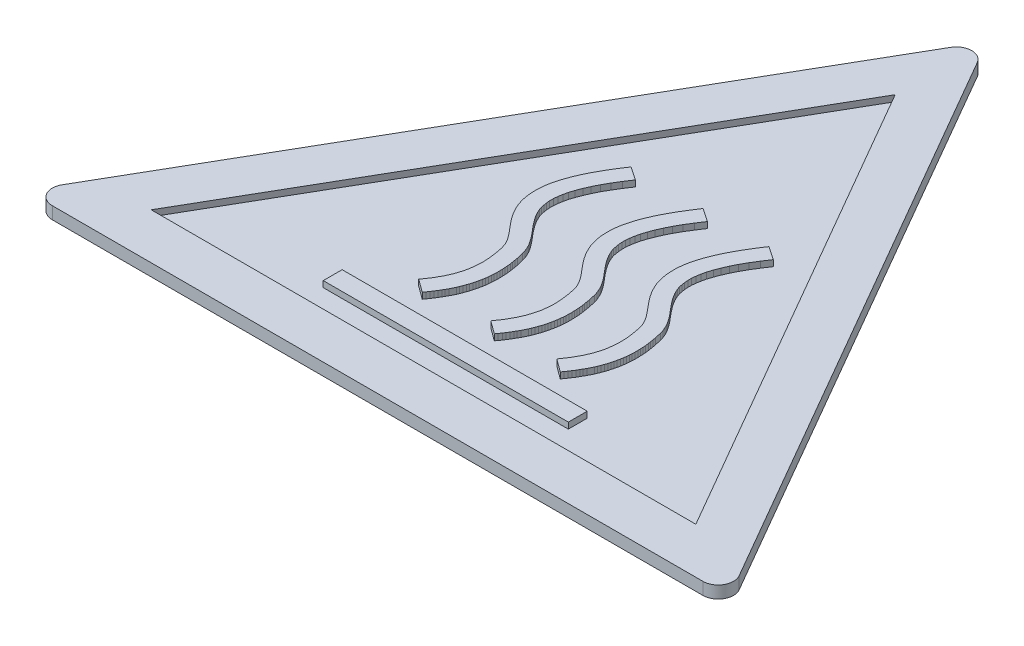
SolidWorks part; units mm, degrees
ref_plane "Vorne" through (0, 0, 0) normal (0, 0, 1) x (1, 0, 0)
ref_plane "Oben" through (0, 0, 0) normal (0, 1, 0) x (1, 0, 0)
ref_plane "Rechts" through (0, 0, 0) normal (1, 0, 0) x (0, 0, -1)
sketch "Skizze1" plane through (0, 0, 0) normal (0, 1, 0) x (1, 0, 0)
  line L0 (-15.8835, 2.5) -> (18.1545, 2.5) construction
  line L1 (0, -5.5346) -> (0, 10.5158) construction
  line L3 (-12.5, 15) -> (12.5, 15)
  line L4 (-12.5, 15) -> (-12.5, -10)
  line L5 (-12.5, -10) -> (12.5, -10)
  line L6 (12.5, 15) -> (12.5, -10)
  dimension "D1" = 25
  dimension "D2" = 25
  dimension "D3" = 2.5
extrude "Linear austragen1" add sketch "Skizze1" along normal blind 0.2
sketch "Skizze2" plane through (0, 0.2, 0) normal (0, 1, 0) x (-1, 0, 0)
  line L0 (11.5, 6.6395) -> (-5.75, -3.3198) construction
  line L1 (-11.5, 6.6395) -> (5.75, -3.3198) construction
  line L2 (0, -13.2791) -> (0, 6.6395) construction
  line L3 (11.5, 6.6395) -> (0, -13.2791)
  line L4 (0, -13.2791) -> (-11.5, 6.6395)
  line L5 (-11.5, 6.6395) -> (11.5, 6.6395)
  point P0 (0, 0)
  dimension "D1" = 23
extrude "Linear-Austragen-Dünn1" add sketch "Skizze2" along normal blind 0.2 thin
fillet "Verrundung1" radius 0.5 3 edges at (0, 0.3, -13.2791) (11.5, 0.3, 6.6395) (-11.5, 0.3, 6.6395)
sketch "Skizze3" plane through (-0.9352, 0.2, 1.0338) normal (0, 1, 0) x (1, 0, 0)
  line L0 (-0.6601, 0.7186) -> (-0.6939, 0.8367)
  line L3 (-0.6939, 0.8367) -> (-0.7411, 0.9481)
  line L4 (-0.7411, 0.9481) -> (-0.7917, 1.0527)
  line L5 (-0.7917, 1.0527) -> (-0.8525, 1.1505)
  line L6 (-0.8525, 1.1505) -> (-0.9166, 1.245)
  line L7 (-0.9166, 1.245) -> (-0.9841, 1.3361)
  line L8 (-0.9841, 1.3361) -> (-1.0516, 1.4205)
  line L9 (-1.0516, 1.4205) -> (-1.1225, 1.5049)
  line L10 (-1.1225, 1.5049) -> (-1.1899, 1.5859)
  line L11 (-1.1899, 1.5859) -> (-1.2608, 1.6702)
  line L12 (-1.2608, 1.6702) -> (-1.3216, 1.7479)
  line L13 (-1.3216, 1.7479) -> (-1.3857, 1.8322)
  line L14 (-1.3857, 1.8322) -> (-1.443, 1.9098)
  line L15 (-1.443, 1.9098) -> (-1.497, 1.9942)
  line L16 (-1.497, 1.9942) -> (-1.5477, 2.0786)
  line L17 (-1.5477, 2.0786) -> (-1.5915, 2.1663)
  line L18 (-1.5915, 2.1663) -> (-1.632, 2.2574)
  line L19 (-1.632, 2.2574) -> (-1.6624, 2.3452)
  line L20 (-1.6624, 2.3452) -> (-1.6826, 2.4464)
  line L21 (-1.6826, 2.4464) -> (-1.6995, 2.551)
  line L22 (-1.6995, 2.551) -> (-1.7096, 2.6658)
  line L23 (-1.7096, 2.6658) -> (-1.7096, 2.7872)
  line L24 (-1.7096, 2.7872) -> (-1.6961, 2.9155)
  line L25 (-1.6961, 2.9155) -> (-1.6725, 3.0572)
  line L26 (-1.6725, 3.0572) -> (-1.6388, 3.2091)
  line L27 (-1.6388, 3.2091) -> (-1.5848, 3.3744)
  line L28 (-1.5848, 3.3744) -> (-1.5173, 3.5533)
  line L29 (-1.5173, 3.5533) -> (-1.4329, 3.7456)
  line L30 (-1.4329, 3.7456) -> (-1.3317, 3.9515)
  line L31 (-1.3317, 3.9515) -> (-1.2102, 4.1675)
  line L32 (-1.2102, 4.1675) -> (-1.0651, 4.4037)
  line L33 (-1.0651, 4.4037) -> (-0.8997, 4.6534)
  line L34 (-0.8997, 4.6534) -> (-1.3384, 4.9504)
  line L35 (-1.3384, 4.9504) -> (-1.5105, 4.6872)
  line L36 (-1.5105, 4.6872) -> (-1.6624, 4.4374)
  line L37 (-1.6624, 4.4374) -> (-1.7974, 4.1945)
  line L38 (-1.7974, 4.1945) -> (-1.9121, 3.9684)
  line L39 (-1.9121, 3.9684) -> (-2.0032, 3.7558)
  line L40 (-2.0032, 3.7558) -> (-2.0842, 3.5499)
  line L41 (-2.0842, 3.5499) -> (-2.145, 3.3508)
  line L42 (-2.145, 3.3508) -> (-2.1922, 3.1652)
  line L43 (-2.1922, 3.1652) -> (-2.2226, 2.983)
  line L44 (-2.2226, 2.983) -> (-2.2361, 2.8075)
  line L45 (-2.2361, 2.8075) -> (-2.2361, 2.6455)
  line L46 (-2.2361, 2.6455) -> (-2.226, 2.4903)
  line L47 (-2.226, 2.4903) -> (-2.2023, 2.3452)
  line L48 (-2.2023, 2.3452) -> (-2.1686, 2.2034)
  line L49 (-2.1686, 2.2034) -> (-2.1247, 2.0684)
  line L50 (-2.1247, 2.0684) -> (-2.0707, 1.9436)
  line L51 (-2.0707, 1.9436) -> (-2.0134, 1.8288)
  line L52 (-2.0134, 1.8288) -> (-1.9492, 1.7175)
  line L53 (-1.9492, 1.7175) -> (-1.8818, 1.6129)
  line L54 (-1.8818, 1.6129) -> (-1.8109, 1.515)
  line L55 (-1.8109, 1.515) -> (-1.74, 1.4239)
  line L56 (-1.74, 1.4239) -> (-1.6658, 1.3328)
  line L57 (-1.6658, 1.3328) -> (-1.5949, 1.2484)
  line L58 (-1.5949, 1.2484) -> (-1.5274, 1.1674)
  line L59 (-1.5274, 1.1674) -> (-1.4633, 1.0898)
  line L60 (-1.4633, 1.0898) -> (-1.4026, 1.0122)
  line L61 (-1.4026, 1.0122) -> (-1.3486, 0.9413)
  line L62 (-1.3486, 0.9413) -> (-1.2979, 0.8671)
  line L63 (-1.2979, 0.8671) -> (-1.2574, 0.7962)
  line L64 (-1.2574, 0.7962) -> (-1.2203, 0.7253)
  line L65 (-1.2203, 0.7253) -> (-1.1933, 0.6612)
  line L66 (-1.1933, 0.6612) -> (-1.1731, 0.5903)
  line L68 (-1.2034, -2.0081) -> (-1.1495, -1.9339)
  line L69 (-1.1495, -1.9339) -> (-1.0955, -1.8563)
  line L70 (-1.0955, -1.8563) -> (-1.0482, -1.782)
  line L71 (-1.0482, -1.782) -> (-0.9942, -1.701)
  line L72 (-0.9942, -1.701) -> (-0.9503, -1.62)
  line L73 (-0.9503, -1.62) -> (-0.9099, -1.5526)
  line L74 (-0.9099, -1.5526) -> (-0.866, -1.4749)
  line L75 (-0.866, -1.4749) -> (-0.8255, -1.3939)
  line L76 (-0.8255, -1.3939) -> (-0.785, -1.313)
  line L77 (-0.785, -1.313) -> (-0.7546, -1.2387)
  line L78 (-0.7546, -1.2387) -> (-0.7209, -1.1543)
  line L79 (-0.7209, -1.1543) -> (-0.6939, -1.0734)
  line L80 (-0.6939, -1.0734) -> (-0.6635, -0.9957)
  line L81 (-0.6635, -0.9957) -> (-0.6433, -0.9114)
  line L82 (-0.6433, -0.9114) -> (-0.6196, -0.8304)
  line L83 (-0.6196, -0.8304) -> (-0.6028, -0.7494)
  line L84 (-0.6028, -0.7494) -> (-0.5825, -0.6583)
  line L85 (-0.5825, -0.6583) -> (-0.569, -0.5739)
  line L86 (-0.569, -0.5739) -> (-0.5589, -0.4895)
  line L87 (-0.5589, -0.4895) -> (-0.5521, -0.4018)
  line L88 (-0.5521, -0.4018) -> (-0.5454, -0.3208)
  line L89 (-0.5454, -0.3208) -> (-0.542, -0.2297)
  line L90 (-0.542, -0.2297) -> (-0.542, -0.1352)
  line L91 (-0.542, -0.1352) -> (-0.5454, -0.0475)
  line L92 (-0.5454, -0.0475) -> (-0.5488, 0.0437)
  line L93 (-0.5488, 0.0437) -> (-0.5555, 0.1348)
  line L94 (-0.5555, 0.1348) -> (-0.5656, 0.2326)
  line L95 (-0.5656, 0.2326) -> (-0.5825, 0.3271)
  line L96 (-0.5825, 0.3271) -> (-0.596, 0.4182)
  line L97 (-0.596, 0.4182) -> (-0.6129, 0.5161)
  line L98 (-0.6129, 0.5161) -> (-0.6365, 0.6173)
  line L99 (-0.6365, 0.6173) -> (-0.6601, 0.7186)
  line L101 (-1.1731, 0.5903) -> (-1.1495, 0.5026)
  line L102 (-1.1495, 0.5026) -> (-1.1326, 0.4149)
  line L103 (-1.1326, 0.4149) -> (-1.1157, 0.3305)
  line L104 (-1.1157, 0.3305) -> (-1.1022, 0.2461)
  line L105 (-1.1022, 0.2461) -> (-1.0921, 0.1651)
  line L106 (-1.0921, 0.1651) -> (-1.082, 0.0875)
  line L107 (-1.082, 0.0875) -> (-1.0752, 0.0099)
  line L108 (-1.0752, 0.0099) -> (-1.0718, -0.0677)
  line L109 (-1.0718, -0.0677) -> (-1.0685, -0.1487)
  line L110 (-1.0685, -0.1487) -> (-1.0685, -0.2162)
  line L111 (-1.0685, -0.2162) -> (-1.0718, -0.2871)
  line L112 (-1.0718, -0.2871) -> (-1.0786, -0.3613)
  line L113 (-1.0786, -0.3613) -> (-1.0853, -0.4355)
  line L114 (-1.0853, -0.4355) -> (-1.0955, -0.5064)
  line L115 (-1.0955, -0.5064) -> (-1.1022, -0.5705)
  line L116 (-1.1022, -0.5705) -> (-1.1157, -0.6347)
  line L117 (-1.1157, -0.6347) -> (-1.1326, -0.7021)
  line L118 (-1.1326, -0.7021) -> (-1.1495, -0.7696)
  line L119 (-1.1495, -0.7696) -> (-1.1697, -0.8338)
  line L120 (-1.1697, -0.8338) -> (-1.1933, -0.9046)
  line L121 (-1.1933, -0.9046) -> (-1.2136, -0.9721)
  line L122 (-1.2136, -0.9721) -> (-1.2406, -1.0295)
  line L123 (-1.2406, -1.0295) -> (-1.2709, -1.097)
  line L124 (-1.2709, -1.097) -> (-1.2979, -1.1645)
  line L125 (-1.2979, -1.1645) -> (-1.3317, -1.2252)
  line L126 (-1.3317, -1.2252) -> (-1.3688, -1.2893)
  line L127 (-1.3688, -1.2893) -> (-1.4093, -1.3636)
  line L128 (-1.4093, -1.3636) -> (-1.4464, -1.4311)
  line L129 (-1.4464, -1.4311) -> (-1.4869, -1.4918)
  line L130 (-1.4869, -1.4918) -> (-1.5342, -1.5593)
  line L131 (-1.5342, -1.5593) -> (-1.5814, -1.6302)
  line L132 (-1.5814, -1.6302) -> (-1.6287, -1.6977)
  line L133 (-1.6287, -1.6977) -> (-1.2034, -2.0081)
  line L134 (1.6954, 0.7186) -> (1.6616, 0.8367)
  line L135 (1.6616, 0.8367) -> (1.6144, 0.9481)
  line L136 (1.6144, 0.9481) -> (1.5638, 1.0527)
  line L137 (1.5638, 1.0527) -> (1.503, 1.1505)
  line L138 (1.503, 1.1505) -> (1.4389, 1.245)
  line L139 (1.4389, 1.245) -> (1.3714, 1.3361)
  line L140 (1.3714, 1.3361) -> (1.3039, 1.4205)
  line L141 (1.3039, 1.4205) -> (1.2331, 1.5049)
  line L142 (1.2331, 1.5049) -> (1.1656, 1.5859)
  line L143 (1.1656, 1.5859) -> (1.0947, 1.6702)
  line L144 (1.0947, 1.6702) -> (1.0339, 1.7479)
  line L145 (1.0339, 1.7479) -> (0.9698, 1.8322)
  line L146 (0.9698, 1.8322) -> (0.9125, 1.9098)
  line L147 (0.9125, 1.9098) -> (0.8585, 1.9942)
  line L148 (0.8585, 1.9942) -> (0.8078, 2.0786)
  line L149 (0.8078, 2.0786) -> (0.764, 2.1663)
  line L150 (0.764, 2.1663) -> (0.7235, 2.2574)
  line L151 (0.7235, 2.2574) -> (0.6931, 2.3452)
  line L152 (0.6931, 2.3452) -> (0.6729, 2.4464)
  line L153 (0.6729, 2.4464) -> (0.656, 2.551)
  line L154 (0.656, 2.551) -> (0.6459, 2.6658)
  line L155 (0.6459, 2.6658) -> (0.6459, 2.7872)
  line L156 (0.6459, 2.7872) -> (0.6594, 2.9155)
  line L157 (0.6594, 2.9155) -> (0.683, 3.0572)
  line L158 (0.683, 3.0572) -> (0.7167, 3.2091)
  line L159 (0.7167, 3.2091) -> (0.7707, 3.3744)
  line L160 (0.7707, 3.3744) -> (0.8382, 3.5533)
  line L161 (0.8382, 3.5533) -> (0.9226, 3.7456)
  line L162 (0.9226, 3.7456) -> (1.0238, 3.9515)
  line L163 (1.0238, 3.9515) -> (1.1453, 4.1675)
  line L164 (1.1453, 4.1675) -> (1.2904, 4.4037)
  line L165 (1.2904, 4.4037) -> (1.4558, 4.6534)
  line L166 (1.4558, 4.6534) -> (1.0171, 4.9504)
  line L167 (1.0171, 4.9504) -> (0.845, 4.6872)
  line L168 (0.845, 4.6872) -> (0.6931, 4.4374)
  line L169 (0.6931, 4.4374) -> (0.5581, 4.1945)
  line L170 (0.5581, 4.1945) -> (0.4434, 3.9684)
  line L171 (0.4434, 3.9684) -> (0.3523, 3.7558)
  line L172 (0.3523, 3.7558) -> (0.2713, 3.5499)
  line L173 (0.2713, 3.5499) -> (0.2105, 3.3508)
  line L174 (0.2105, 3.3508) -> (0.1633, 3.1652)
  line L175 (0.1633, 3.1652) -> (0.1329, 2.983)
  line L176 (0.1329, 2.983) -> (0.1194, 2.8075)
  line L177 (0.1194, 2.8075) -> (0.1194, 2.6455)
  line L178 (0.1194, 2.6455) -> (0.1295, 2.4903)
  line L179 (0.1295, 2.4903) -> (0.1532, 2.3452)
  line L180 (0.1532, 2.3452) -> (0.1869, 2.2034)
  line L181 (0.1869, 2.2034) -> (0.2308, 2.0684)
  line L182 (0.2308, 2.0684) -> (0.2848, 1.9436)
  line L183 (0.2848, 1.9436) -> (0.3421, 1.8288)
  line L184 (0.3421, 1.8288) -> (0.4063, 1.7175)
  line L185 (0.4063, 1.7175) -> (0.4738, 1.6129)
  line L186 (0.4738, 1.6129) -> (0.5446, 1.515)
  line L187 (0.5446, 1.515) -> (0.6155, 1.4239)
  line L188 (0.6155, 1.4239) -> (0.6897, 1.3328)
  line L189 (0.6897, 1.3328) -> (0.7606, 1.2484)
  line L190 (0.7606, 1.2484) -> (0.8281, 1.1674)
  line L191 (0.8281, 1.1674) -> (0.8922, 1.0898)
  line L192 (0.8922, 1.0898) -> (0.953, 1.0122)
  line L193 (0.953, 1.0122) -> (1.007, 0.9413)
  line L194 (1.007, 0.9413) -> (1.0576, 0.8671)
  line L195 (1.0576, 0.8671) -> (1.0981, 0.7962)
  line L196 (1.0981, 0.7962) -> (1.1352, 0.7253)
  line L197 (1.1352, 0.7253) -> (1.1622, 0.6612)
  line L198 (1.1622, 0.6612) -> (1.1824, 0.5903)
  line L200 (1.1521, -2.0081) -> (1.2061, -1.9339)
  line L201 (1.2061, -1.9339) -> (1.26, -1.8563)
  line L202 (1.26, -1.8563) -> (1.3073, -1.782)
  line L203 (1.3073, -1.782) -> (1.3613, -1.701)
  line L204 (1.3613, -1.701) -> (1.4052, -1.62)
  line L205 (1.4052, -1.62) -> (1.4457, -1.5526)
  line L206 (1.4457, -1.5526) -> (1.4895, -1.4749)
  line L207 (1.4895, -1.4749) -> (1.53, -1.3939)
  line L208 (1.53, -1.3939) -> (1.5705, -1.313)
  line L209 (1.5705, -1.313) -> (1.6009, -1.2387)
  line L210 (1.6009, -1.2387) -> (1.6346, -1.1543)
  line L211 (1.6346, -1.1543) -> (1.6616, -1.0734)
  line L212 (1.6616, -1.0734) -> (1.692, -0.9957)
  line L213 (1.692, -0.9957) -> (1.7123, -0.9114)
  line L214 (1.7123, -0.9114) -> (1.7359, -0.8304)
  line L215 (1.7359, -0.8304) -> (1.7527, -0.7494)
  line L216 (1.7527, -0.7494) -> (1.773, -0.6583)
  line L217 (1.773, -0.6583) -> (1.7865, -0.5739)
  line L218 (1.7865, -0.5739) -> (1.7966, -0.4895)
  line L219 (1.7966, -0.4895) -> (1.8034, -0.4018)
  line L220 (1.8034, -0.4018) -> (1.8101, -0.3208)
  line L221 (1.8101, -0.3208) -> (1.8135, -0.2297)
  line L222 (1.8135, -0.2297) -> (1.8135, -0.1352)
  line L223 (1.8135, -0.1352) -> (1.8101, -0.0475)
  line L224 (1.8101, -0.0475) -> (1.8067, 0.0437)
  line L225 (1.8067, 0.0437) -> (1.8, 0.1348)
  line L226 (1.8, 0.1348) -> (1.7899, 0.2326)
  line L227 (1.7899, 0.2326) -> (1.773, 0.3271)
  line L228 (1.773, 0.3271) -> (1.7595, 0.4182)
  line L229 (1.7595, 0.4182) -> (1.7426, 0.5161)
  line L230 (1.7426, 0.5161) -> (1.719, 0.6173)
  line L231 (1.719, 0.6173) -> (1.6954, 0.7186)
  line L233 (1.1824, 0.5903) -> (1.2061, 0.5026)
  line L234 (1.2061, 0.5026) -> (1.2229, 0.4149)
  line L235 (1.2229, 0.4149) -> (1.2398, 0.3305)
  line L236 (1.2398, 0.3305) -> (1.2533, 0.2461)
  line L237 (1.2533, 0.2461) -> (1.2634, 0.1651)
  line L238 (1.2634, 0.1651) -> (1.2735, 0.0875)
  line L239 (1.2735, 0.0875) -> (1.2803, 0.0099)
  line L240 (1.2803, 0.0099) -> (1.2837, -0.0677)
  line L241 (1.2837, -0.0677) -> (1.287, -0.1487)
  line L242 (1.287, -0.1487) -> (1.287, -0.2162)
  line L243 (1.287, -0.2162) -> (1.2837, -0.2871)
  line L244 (1.2837, -0.2871) -> (1.2769, -0.3613)
  line L245 (1.2769, -0.3613) -> (1.2702, -0.4355)
  line L246 (1.2702, -0.4355) -> (1.26, -0.5064)
  line L247 (1.26, -0.5064) -> (1.2533, -0.5705)
  line L248 (1.2533, -0.5705) -> (1.2398, -0.6347)
  line L249 (1.2398, -0.6347) -> (1.2229, -0.7021)
  line L250 (1.2229, -0.7021) -> (1.2061, -0.7696)
  line L251 (1.2061, -0.7696) -> (1.1858, -0.8338)
  line L252 (1.1858, -0.8338) -> (1.1622, -0.9046)
  line L253 (1.1622, -0.9046) -> (1.1419, -0.9721)
  line L254 (1.1419, -0.9721) -> (1.1149, -1.0295)
  line L255 (1.1149, -1.0295) -> (1.0846, -1.097)
  line L256 (1.0846, -1.097) -> (1.0576, -1.1645)
  line L257 (1.0576, -1.1645) -> (1.0238, -1.2252)
  line L258 (1.0238, -1.2252) -> (0.9867, -1.2893)
  line L259 (0.9867, -1.2893) -> (0.9462, -1.3636)
  line L260 (0.9462, -1.3636) -> (0.9091, -1.4311)
  line L261 (0.9091, -1.4311) -> (0.8686, -1.4918)
  line L262 (0.8686, -1.4918) -> (0.8213, -1.5593)
  line L263 (0.8213, -1.5593) -> (0.7741, -1.6302)
  line L264 (0.7741, -1.6302) -> (0.7269, -1.6977)
  line L265 (0.7269, -1.6977) -> (1.1521, -2.0081)
  line L266 (3.8518, 0.7186) -> (3.818, 0.8367)
  line L267 (3.818, 0.8367) -> (3.7708, 0.9481)
  line L268 (3.7708, 0.9481) -> (3.7202, 1.0527)
  line L269 (3.7202, 1.0527) -> (3.6594, 1.1505)
  line L270 (3.6594, 1.1505) -> (3.5953, 1.245)
  line L271 (3.5953, 1.245) -> (3.5278, 1.3361)
  line L272 (3.5278, 1.3361) -> (3.4603, 1.4205)
  line L273 (3.4603, 1.4205) -> (3.3895, 1.5049)
  line L274 (3.3895, 1.5049) -> (3.322, 1.5859)
  line L275 (3.322, 1.5859) -> (3.2511, 1.6702)
  line L276 (3.2511, 1.6702) -> (3.1903, 1.7479)
  line L277 (3.1903, 1.7479) -> (3.1262, 1.8322)
  line L278 (3.1262, 1.8322) -> (3.0689, 1.9098)
  line L279 (3.0689, 1.9098) -> (3.0149, 1.9942)
  line L280 (3.0149, 1.9942) -> (2.9642, 2.0786)
  line L281 (2.9642, 2.0786) -> (2.9204, 2.1663)
  line L282 (2.9204, 2.1663) -> (2.8799, 2.2574)
  line L283 (2.8799, 2.2574) -> (2.8495, 2.3452)
  line L284 (2.8495, 2.3452) -> (2.8293, 2.4464)
  line L285 (2.8293, 2.4464) -> (2.8124, 2.551)
  line L286 (2.8124, 2.551) -> (2.8023, 2.6658)
  line L287 (2.8023, 2.6658) -> (2.8023, 2.7872)
  line L288 (2.8023, 2.7872) -> (2.8158, 2.9155)
  line L289 (2.8158, 2.9155) -> (2.8394, 3.0572)
  line L290 (2.8394, 3.0572) -> (2.8731, 3.2091)
  line L291 (2.8731, 3.2091) -> (2.9271, 3.3744)
  line L292 (2.9271, 3.3744) -> (2.9946, 3.5533)
  line L293 (2.9946, 3.5533) -> (3.079, 3.7456)
  line L294 (3.079, 3.7456) -> (3.1802, 3.9515)
  line L295 (3.1802, 3.9515) -> (3.3017, 4.1675)
  line L296 (3.3017, 4.1675) -> (3.4468, 4.4037)
  line L297 (3.4468, 4.4037) -> (3.6122, 4.6534)
  line L298 (3.6122, 4.6534) -> (3.1735, 4.9504)
  line L299 (3.1735, 4.9504) -> (3.0014, 4.6872)
  line L300 (3.0014, 4.6872) -> (2.8495, 4.4374)
  line L301 (2.8495, 4.4374) -> (2.7145, 4.1945)
  line L302 (2.7145, 4.1945) -> (2.5998, 3.9684)
  line L303 (2.5998, 3.9684) -> (2.5087, 3.7558)
  line L304 (2.5087, 3.7558) -> (2.4277, 3.5499)
  line L305 (2.4277, 3.5499) -> (2.3669, 3.3508)
  line L306 (2.3669, 3.3508) -> (2.3197, 3.1652)
  line L307 (2.3197, 3.1652) -> (2.2893, 2.983)
  line L308 (2.2893, 2.983) -> (2.2758, 2.8075)
  line L309 (2.2758, 2.8075) -> (2.2758, 2.6455)
  line L310 (2.2758, 2.6455) -> (2.2859, 2.4903)
  line L311 (2.2859, 2.4903) -> (2.3096, 2.3452)
  line L312 (2.3096, 2.3452) -> (2.3433, 2.2034)
  line L313 (2.3433, 2.2034) -> (2.3872, 2.0684)
  line L314 (2.3872, 2.0684) -> (2.4412, 1.9436)
  line L315 (2.4412, 1.9436) -> (2.4985, 1.8288)
  line L316 (2.4985, 1.8288) -> (2.5627, 1.7175)
  line L317 (2.5627, 1.7175) -> (2.6302, 1.6129)
  line L318 (2.6302, 1.6129) -> (2.701, 1.515)
  line L319 (2.701, 1.515) -> (2.7719, 1.4239)
  line L320 (2.7719, 1.4239) -> (2.8461, 1.3328)
  line L321 (2.8461, 1.3328) -> (2.917, 1.2484)
  line L322 (2.917, 1.2484) -> (2.9845, 1.1674)
  line L323 (2.9845, 1.1674) -> (3.0486, 1.0898)
  line L324 (3.0486, 1.0898) -> (3.1094, 1.0122)
  line L325 (3.1094, 1.0122) -> (3.1634, 0.9413)
  line L326 (3.1634, 0.9413) -> (3.214, 0.8671)
  line L327 (3.214, 0.8671) -> (3.2545, 0.7962)
  line L328 (3.2545, 0.7962) -> (3.2916, 0.7253)
  line L329 (3.2916, 0.7253) -> (3.3186, 0.6612)
  line L330 (3.3186, 0.6612) -> (3.3388, 0.5903)
  line L332 (3.3085, -2.0081) -> (3.3625, -1.9339)
  line L333 (3.3625, -1.9339) -> (3.4165, -1.8563)
  line L334 (3.4165, -1.8563) -> (3.4637, -1.782)
  line L335 (3.4637, -1.782) -> (3.5177, -1.701)
  line L336 (3.5177, -1.701) -> (3.5616, -1.62)
  line L337 (3.5616, -1.62) -> (3.6021, -1.5526)
  line L338 (3.6021, -1.5526) -> (3.6459, -1.4749)
  line L339 (3.6459, -1.4749) -> (3.6864, -1.3939)
  line L340 (3.6864, -1.3939) -> (3.7269, -1.313)
  line L341 (3.7269, -1.313) -> (3.7573, -1.2387)
  line L342 (3.7573, -1.2387) -> (3.791, -1.1543)
  line L343 (3.791, -1.1543) -> (3.818, -1.0734)
  line L344 (3.818, -1.0734) -> (3.8484, -0.9957)
  line L345 (3.8484, -0.9957) -> (3.8687, -0.9114)
  line L346 (3.8687, -0.9114) -> (3.8923, -0.8304)
  line L347 (3.8923, -0.8304) -> (3.9091, -0.7494)
  line L348 (3.9091, -0.7494) -> (3.9294, -0.6583)
  line L349 (3.9294, -0.6583) -> (3.9429, -0.5739)
  line L350 (3.9429, -0.5739) -> (3.953, -0.4895)
  line L351 (3.953, -0.4895) -> (3.9598, -0.4018)
  line L352 (3.9598, -0.4018) -> (3.9665, -0.3208)
  line L353 (3.9665, -0.3208) -> (3.9699, -0.2297)
  line L354 (3.9699, -0.2297) -> (3.9699, -0.1352)
  line L355 (3.9699, -0.1352) -> (3.9665, -0.0475)
  line L356 (3.9665, -0.0475) -> (3.9631, 0.0437)
  line L357 (3.9631, 0.0437) -> (3.9564, 0.1348)
  line L358 (3.9564, 0.1348) -> (3.9463, 0.2326)
  line L359 (3.9463, 0.2326) -> (3.9294, 0.3271)
  line L360 (3.9294, 0.3271) -> (3.9159, 0.4182)
  line L361 (3.9159, 0.4182) -> (3.899, 0.5161)
  line L362 (3.899, 0.5161) -> (3.8754, 0.6173)
  line L363 (3.8754, 0.6173) -> (3.8518, 0.7186)
  line L365 (3.3388, 0.5903) -> (3.3625, 0.5026)
  line L366 (3.3625, 0.5026) -> (3.3793, 0.4149)
  line L367 (3.3793, 0.4149) -> (3.3962, 0.3305)
  line L368 (3.3962, 0.3305) -> (3.4097, 0.2461)
  line L369 (3.4097, 0.2461) -> (3.4198, 0.1651)
  line L370 (3.4198, 0.1651) -> (3.4299, 0.0875)
  line L371 (3.4299, 0.0875) -> (3.4367, 0.0099)
  line L372 (3.4367, 0.0099) -> (3.4401, -0.0677)
  line L373 (3.4401, -0.0677) -> (3.4434, -0.1487)
  line L374 (3.4434, -0.1487) -> (3.4434, -0.2162)
  line L375 (3.4434, -0.2162) -> (3.4401, -0.2871)
  line L376 (3.4401, -0.2871) -> (3.4333, -0.3613)
  line L377 (3.4333, -0.3613) -> (3.4266, -0.4355)
  line L378 (3.4266, -0.4355) -> (3.4165, -0.5064)
  line L379 (3.4165, -0.5064) -> (3.4097, -0.5705)
  line L380 (3.4097, -0.5705) -> (3.3962, -0.6347)
  line L381 (3.3962, -0.6347) -> (3.3793, -0.7021)
  line L382 (3.3793, -0.7021) -> (3.3625, -0.7696)
  line L383 (3.3625, -0.7696) -> (3.3422, -0.8338)
  line L384 (3.3422, -0.8338) -> (3.3186, -0.9046)
  line L385 (3.3186, -0.9046) -> (3.2983, -0.9721)
  line L386 (3.2983, -0.9721) -> (3.2713, -1.0295)
  line L387 (3.2713, -1.0295) -> (3.241, -1.097)
  line L388 (3.241, -1.097) -> (3.214, -1.1645)
  line L389 (3.214, -1.1645) -> (3.1802, -1.2252)
  line L390 (3.1802, -1.2252) -> (3.1431, -1.2893)
  line L391 (3.1431, -1.2893) -> (3.1026, -1.3636)
  line L392 (3.1026, -1.3636) -> (3.0655, -1.4311)
  line L393 (3.0655, -1.4311) -> (3.025, -1.4918)
  line L394 (3.025, -1.4918) -> (2.9777, -1.5593)
  line L395 (2.9777, -1.5593) -> (2.9305, -1.6302)
  line L396 (2.9305, -1.6302) -> (2.8833, -1.6977)
  line L397 (2.8833, -1.6977) -> (3.3085, -2.0081)
  line L398 (-3.1506, -2.6797) -> (4.8608, -2.6797)
  line L399 (4.8608, -2.6797) -> (4.8608, -3.2972)
  line L400 (4.8608, -3.2972) -> (-3.1506, -3.2972)
  line L401 (-3.1506, -3.2972) -> (-3.1506, -2.6797)
extrude "Linear austragen2" add sketch "Skizze3" along normal blind 0.2
sketch "Skizze4" plane through (0, 0.4, 0) normal (0, 1, 0) x (-1, 0, 0)
  line L3 (-11.067, 5.8895) -> (-0.433, -12.5291)
  line L4 (0.433, -12.5291) -> (11.067, 5.8895)
  line L5 (10.634, 6.6395) -> (-10.634, 6.6395)
  line L6 (-11.067, 5.8895) -> (-0.433, -12.5291)
  line L7 (0.433, -12.5291) -> (11.067, 5.8895)
  line L8 (10.634, 6.6395) -> (-10.634, 6.6395)
  arc A3 (-0.433, -12.5291) -> (0.433, -12.5291) centre (0, -12.2791) ccw
  arc A4 (11.067, 5.8895) -> (10.634, 6.6395) centre (10.634, 6.1395) ccw
  arc A5 (-10.634, 6.6395) -> (-11.067, 5.8895) centre (-10.634, 6.1395) ccw
  arc A6 (-0.433, -12.5291) -> (0.433, -12.5291) centre (0, -12.2791) ccw
  arc A7 (11.067, 5.8895) -> (10.634, 6.6395) centre (10.634, 6.1395) ccw
  arc A8 (-10.634, 6.6395) -> (-11.067, 5.8895) centre (-10.634, 6.1395) ccw
  dimension "D1" = 0
extrude "Schnitt-Linear austragen1" cut sketch "Skizze4" against normal through all flip side to cut
